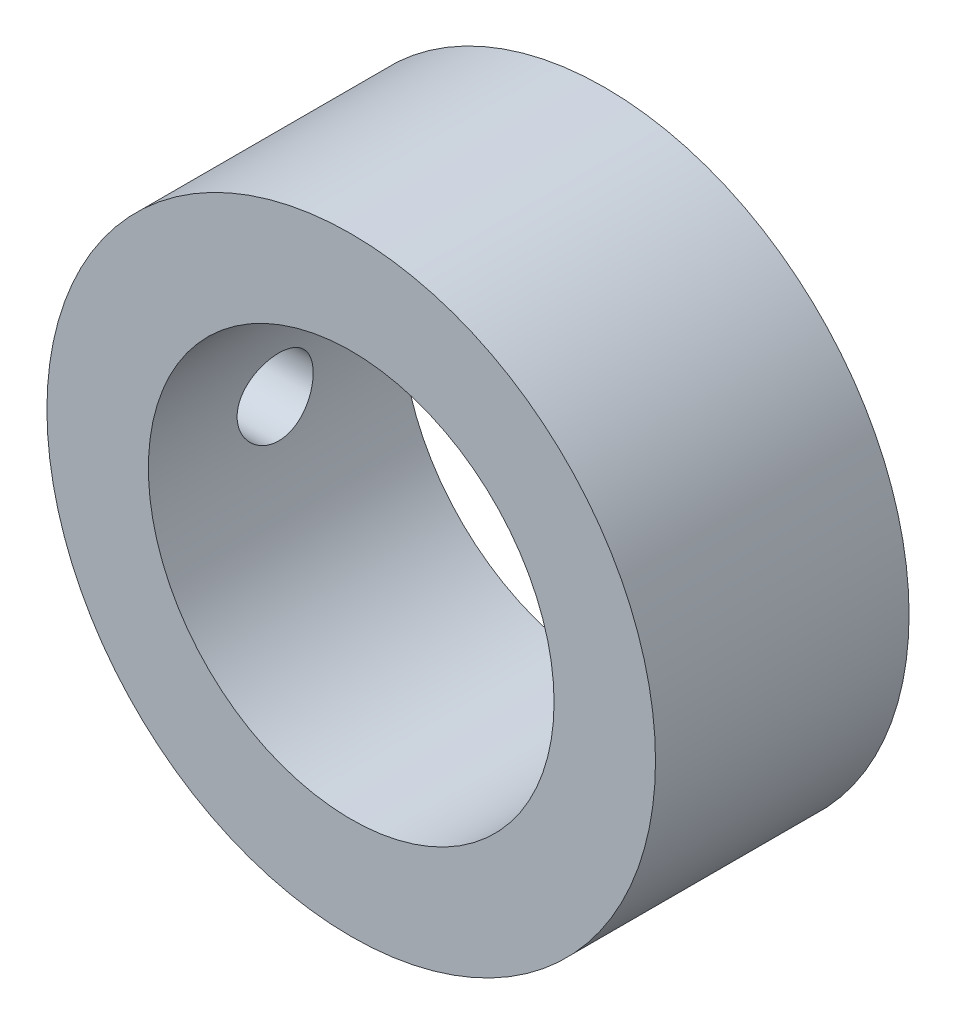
SolidWorks part; units mm, degrees
ref_plane "Plan de face" through (0, 0, 0) normal (0, 0, 1) x (1, 0, 0)
ref_plane "Plan de dessus" through (0, 0, 0) normal (0, 1, 0) x (1, 0, 0)
ref_plane "Plan de droite" through (0, 0, 0) normal (1, 0, 0) x (0, 0, -1)
sketch "Esquisse1" plane through (0, 0, 0) normal (0, 0, 1) x (1, 0, 0)
  circle A0 centre (0, 0) radius 6
  circle A1 centre (0, 0) radius 4
  dimension "D1" = 12
  dimension "D2" = 8
extrude "Boss.-Extru.1" add sketch "Esquisse1" along normal blind 5 contours A0
ref_plane "Plan1" through (-6, 0, 0) normal (-1, 0, 0) x (0, 0, 1)
sketch "Esquisse3" plane through (-6, 0, 0) normal (-1, 0, 0) x (0, 0, 1)
  line L0 (0, 6) -> (5, -6) construction
  point P4 (2.5, 0)
hole_wizard "Perçage1" positions "Esquisse4" profile "Esquisse5" legacy
sketch "Esquisse4" plane through (-6, 0, 0) normal (-1, 0, 0) x (0, 0, 1)
  point P0 (2.5, 0)
sketch "Esquisse5" plane through (-6, 0, 2.5) normal (0, 1, 0) x (0, 0, 1)
  line L0 (0, 0) -> (0, 5.4506)
  line L1 (0, 5.4506) -> (0.75, 5)
  line L2 (0.75, 5) -> (0.75, 0)
  line L4 (0.75, 0) -> (0, 0)
  line L6 (0, 5.4506) -> (-0.75, 5) construction
  line L7 (0, -4.2442) -> (0, 117.3081) construction
  dimension "Diamètre" = 1.5
  dimension "Profondeur" = 5
  dimension "Angle" = 118
thread "Filetage1" pitch 1 start angle 0, offset 1, length 0, pitch 1, diameter 8
ref_plane "Plan2" through (4, 0, -1) normal (0, -1, 0) x (1, 0, 0)
sketch "Profil de filetage1" plane through (4, 0, -1) normal (0, -1, 0) x (1, 0, 0)
  line L0 (0, 0) -> (0, 1) construction
  line L1 (0, 0) -> (0.5413, 0.3125)
  line L2 (0.5413, 0.3125) -> (0.5413, 0.4375)
  line L3 (0.5413, 0.4375) -> (0, 0.75)
  line L4 (0.5413, 0.375) -> (0, 0.375) construction
  line L11 (0, 0) -> (0, 0.75)
  point P2 (0, 0)
  dimension "Pitch" = 1
  dimension "Profile_Angle" = 60
  dimension "Profile_Land" = 0.125
  dimension "Profile_Height" = 0.5413
